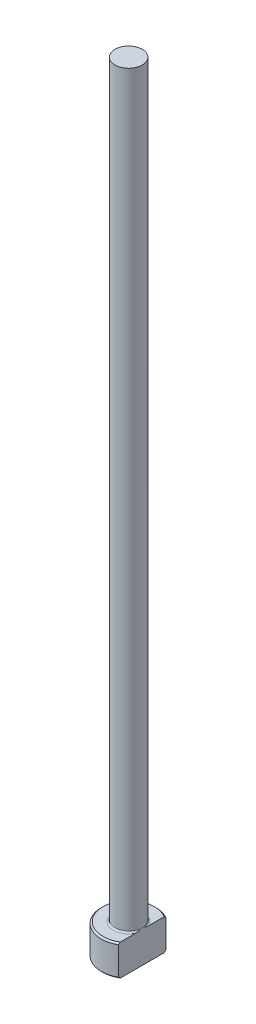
SolidWorks part; units mm, degrees
ref_plane "Front Plane" through (0, 0, 0) normal (0, 0, 1) x (1, 0, 0)
ref_plane "Top Plane" through (0, 0, 0) normal (0, 1, 0) x (1, 0, 0)
ref_plane "Right Plane" through (0, 0, 0) normal (1, 0, 0) x (0, 0, -1)
sketch "Sketch1" plane through (0, 0, 0) normal (0, 0, 1) x (1, 0, 0)
  line L0 (0, 259.9588) -> (0, -15.1925) construction
  line L1 (0, 0) -> (-3.5, 0)
  line L2 (-3.5, 0) -> (-3.5, 4)
  line L3 (-3.5, 4) -> (-1.75, 4)
  line L4 (-1.75, 4) -> (-1.75, 100)
  line L5 (-1.75, 100) -> (0, 100)
  line L6 (0, 100) -> (0, 0)
  dimension "L" = 100
  dimension "H" = 7
  dimension "T" = 4
  dimension "D" = 3.5
revolve "Revolve1" add sketch "Sketch1" angle 360 about L0
chamfer "Chamfer1" distance 0.2 angle 45 2 edges at (0, 4, 3.5) (0, 0, 3.5)
fillet "Fillet1" radius 0.2 1 edges at (0, 4, 1.75)
sketch "Sketch2" plane through (0, 0, 0) normal (0, 1, 0) x (1, 0, 0)
  line L0 (1.75, -3.0311) -> (1.75, 3.0311)
  circle A0 centre (0, 0) radius 3.5 construction
  arc A1 (1.75, -3.0311) -> (1.75, 3.0311) centre (0, 0) ccw
  circle A2 centre (0, 0) radius 1.75 construction
extrude "KEYED HEAD" cut sketch "Sketch2" along normal through all
